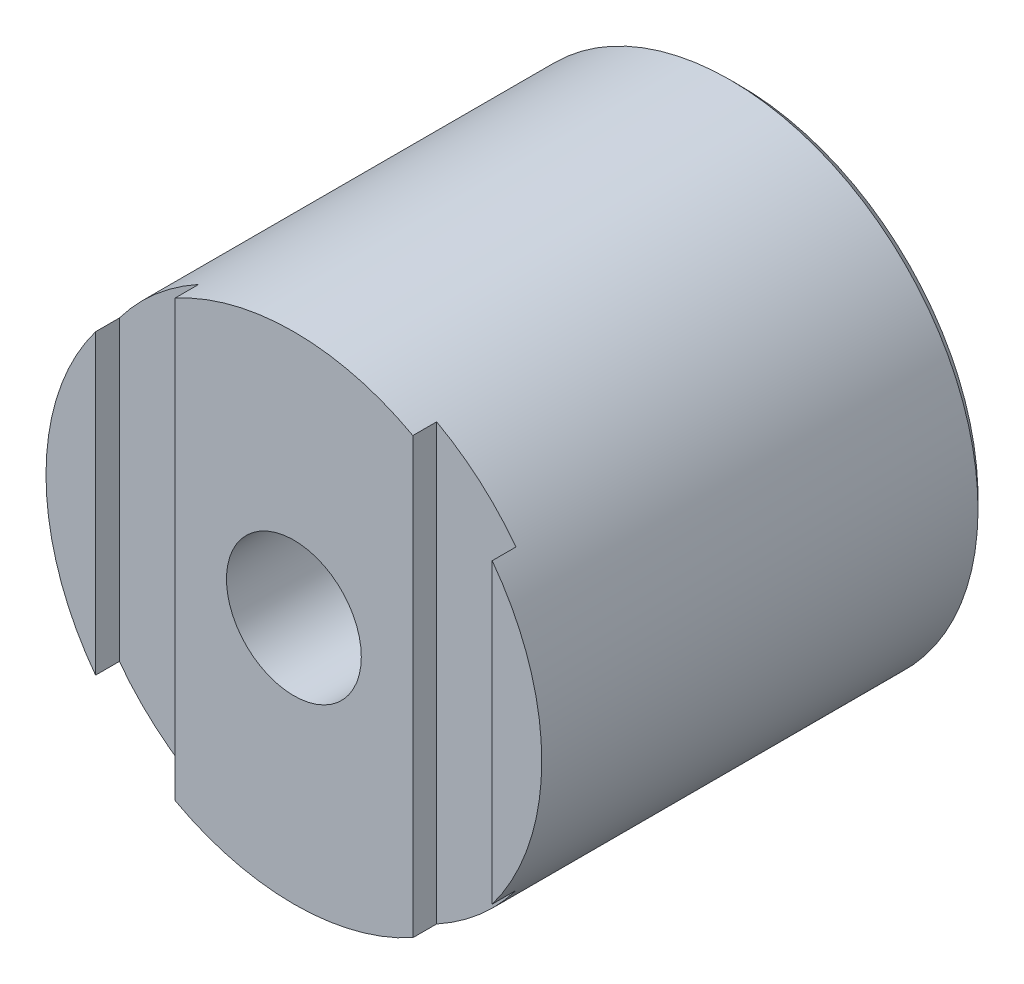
SolidWorks part; units mm, degrees
ref_plane "Face" through (0, 0, 0) normal (0, 0, 1) x (1, 0, 0)
ref_plane "Dessus" through (0, 0, 0) normal (0, 1, 0) x (1, 0, 0)
ref_plane "Droite" through (0, 0, 0) normal (1, 0, 0) x (0, 0, -1)
sketch "Esquisse2" plane through (0, 0, 0) normal (0, 1, 0) x (1, 0, 0)
  line L0 (0, 0) -> (0, 72) construction
  line L2 (0, 0) -> (12.5, 0)
  line L3 (0, 0) -> (0, 22.5)
  line L4 (0, 22.5) -> (12.5, 22.5)
  line L5 (12.5, 0) -> (12.5, 22.5)
  dimension "D1" = 22.5
  dimension "D2" = 25
revolve "Révolution1" add sketch "Esquisse2" angle 360 about L0
sketch "Esquisse3" plane through (0, 0, 0) normal (0, 1, 0) x (1, 0, 0)
  line L0 (0, 0) -> (0, 26) construction
  line L1 (12.5, 22.5) -> (-12.5, 22.5) construction
  line L2 (0, 9.5) -> (0, 22.5)
  line L4 (0, 22.5) -> (7.25, 22.5)
  line L5 (6.5, 16) -> (6.5, 17.75)
  line L6 (6.5, 17.75) -> (8.05, 17.75)
  line L7 (8.05, 17.75) -> (8.05, 19.3)
  line L8 (8.05, 19.3) -> (6.5, 19.3)
  line L9 (6.5, 19.3) -> (6.5, 20.5)
  line L10 (6.5, 20.5) -> (7.25, 21.799)
  line L11 (7.25, 21.799) -> (7.25, 22.5)
  arc A0 (0, 9.5) -> (6.5, 16) centre (0, 16) ccw
  dimension "D1" = 13
  dimension "D2" = 6.5
  dimension "D3" = 3.2
  dimension "D4" = 1.55
  dimension "D5" = 8.05
  dimension "D6" = 14.5
  dimension "D7" = 1.2
  dimension "D8" = 30
revolve "Enlèvement de matière-Révolution1" cut sketch "Esquisse3" angle 360 about L0
sketch "Esquisse6" plane through (0, 0, 0) normal (0, 0, 1) x (1, 0, 0)
  line L0 (0, 0) -> (0, 7) construction
  line L1 (6, 10.9659) -> (6, -10.9659)
  line L2 (10, 7.5) -> (10, -7.5)
  line L3 (-10, 7.5) -> (-10, -7.5)
  line L4 (-6, 10.9659) -> (-6, -10.9659)
  circle A0 centre (0, 0) radius 12.5 construction
  arc A1 (6, -10.9659) -> (10, -7.5) centre (0, 0) ccw
  arc A2 (10, 7.5) -> (6, 10.9659) centre (0, 0) ccw
  arc A3 (-10, 7.5) -> (-6, 10.9659) centre (0, 0) cw
  arc A4 (-6, -10.9659) -> (-10, -7.5) centre (0, 0) cw
  dimension "D1" = 6
  dimension "D2" = 10
extrude "Enlèv. mat.-Extru.1" cut sketch "Esquisse6" against normal blind 1.2
hole_wizard "Trou taraudé M8x1.251" positions "Esquisse8" profile "Esquisse7" tap size "M8x1.25" standard "ISO"
sketch "Esquisse8" plane through (0, 0, 0) normal (0, 0, 1) x (1, 0, 0)
  arc A0 (6, 10.9659) -> (-6, 10.9659) centre (0, 0) ccw construction
  point P0 (0, 0)
sketch "Esquisse7" plane through (0, 0, 0) normal (1, 0, 0) x (0, -1, 0)
  line L0 (0, 0) -> (0, 22.5)
  line L1 (0, 22.5) -> (3.4, 22.5)
  line L2 (3.4, 22.5) -> (3.4, 0)
  line L5 (3.4, 0) -> (0, 0)
  line L11 (0, -6.35) -> (0, 107.95) construction
  dimension "Diamètre du trou pour taraudage jusqu'au prochain" = 6.8
  dimension "Profondeur du trou pour taraudage jusqu'au prochain" = 22.5
chamfer "Chanfrein1" distance 0.5 angle 45
